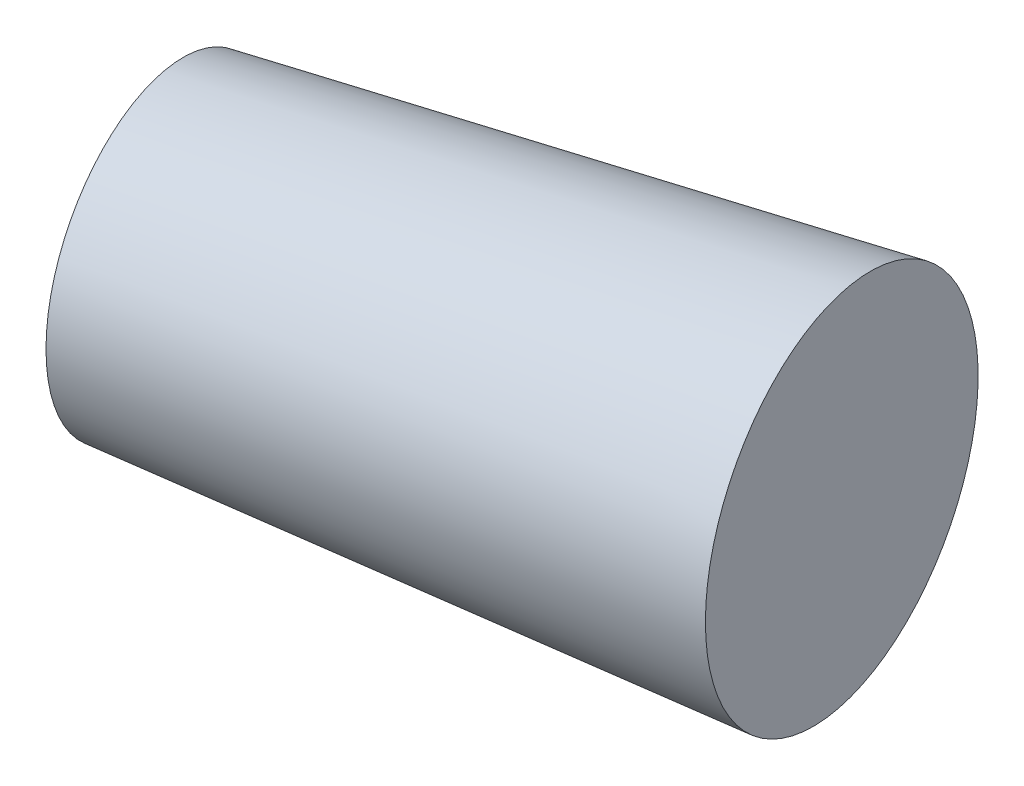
SolidWorks part; units mm, degrees
ref_plane "Plan1" through (0, 0, 0) normal (0, 0, 1) x (1, 0, 0)
ref_plane "Plan2" through (0, 0, 0) normal (0, 1, 0) x (1, 0, 0)
ref_plane "Plan3" through (0, 0, 0) normal (1, 0, 0) x (0, 0, -1)
sketch "Esquisse1" plane through (0, 0, 0) normal (0, 1, 0) x (1, 0, 0)
  line L1 (0, 0) -> (6.625, 1.4529) construction
  line L2 (0, 0) -> (6.625, 1.4529) construction
  line L4 (-4.7266, -3.4856) -> (-5.7514, 1.1878) construction
  line L5 (-5.7514, 1.1878) -> (3.1433, 3.6326) construction
  line L6 (4.375, -1.9839) -> (3.1433, 3.6326) construction
  line L7 (-5.239, -1.1489) -> (3.7592, 0.8244)
  line L8 (-5.239, -1.1489) -> (-5.7514, 1.1878)
  line L9 (-5.7514, 1.1878) -> (3.1433, 3.6326)
  line L10 (3.7592, 0.8244) -> (3.1433, 3.6326)
revolve "Base-Révolution" add sketch "Esquisse1" angle 360 about L2
